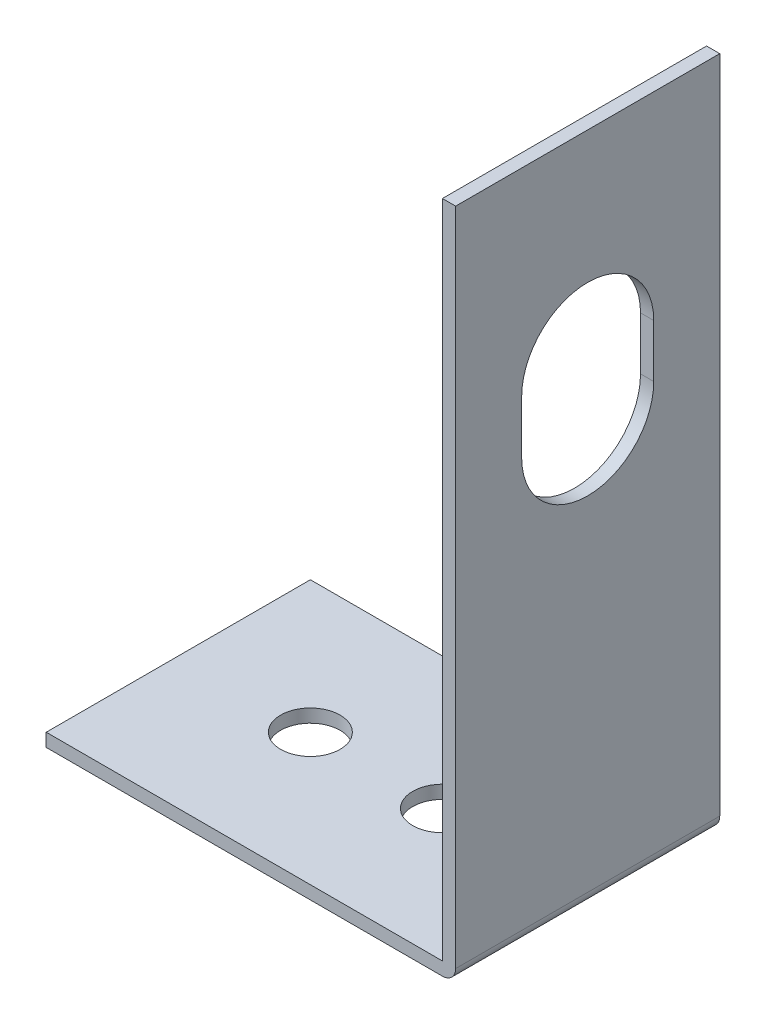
SolidWorks part; units mm, degrees
ref_plane "Plan de face" through (0, 0, 0) normal (0, 0, 1) x (1, 0, 0)
ref_plane "Plan de dessus" through (0, 0, 0) normal (0, 1, 0) x (1, 0, 0)
ref_plane "Plan de droite" through (0, 0, 0) normal (1, 0, 0) x (0, 0, -1)
sketch "Esquisse1" plane through (0, 0, 0) normal (0, 0, 1) x (1, 0, 0)
  line L0 (0, 0) -> (0, 50)
  line L1 (0, 0) -> (-30, 0)
  line L2 (0, -1) -> (-30, -1)
  line L3 (1, 0) -> (1, 50)
  line L4 (0, 50) -> (1, 50)
  line L5 (-30, 0) -> (-30, -1)
  line L6 (1, -1) -> (-30, -1) construction
  line L7 (1, -1) -> (1, 50) construction
  arc A0 (0, -1) -> (1, 0) centre (0, 0) ccw
  dimension "D4" = 1
  dimension "D1" = 50
  dimension "D2" = 30
  dimension "D3" = 1
extrude "Extrusion1" add sketch "Esquisse1" along normal blind 20
sketch "Esquisse2" plane through (0, 0, 0) normal (-1, 0, 0) x (0, 0, 1)
  line L0 (10, 50) -> (10, 0) construction
  line L1 (20, 50) -> (0, 50) construction
  line L2 (20, 0) -> (0, 0) construction
  line L3 (5, 35) -> (5, 31)
  line L4 (15, 35) -> (15, 31)
  arc A0 (15, 35) -> (5, 35) centre (10, 35) ccw
  arc A1 (5, 31) -> (15, 31) centre (10, 31) ccw
  dimension "D1" = 5
  dimension "D2" = 15
  dimension "D3" = 4
extrude "Enlèv. mat.-Extru.1" cut sketch "Esquisse2" against normal blind 20
sketch "Esquisse3" plane through (0, 0, 0) normal (0, 1, 0) x (-1, 0, 0)
  line L0 (0, 10) -> (30, 10) construction
  line L1 (0, 20) -> (0, 0) construction
  line L2 (30, 20) -> (30, 0) construction
  circle A0 centre (10, 10) radius 2.25
  circle A1 centre (20, 10) radius 2.25
  dimension "D1" = 4.5
  dimension "D2" = 10
  dimension "D3" = 10
extrude "Enlèv. mat.-Extru.2" cut sketch "Esquisse3" against normal blind 20
